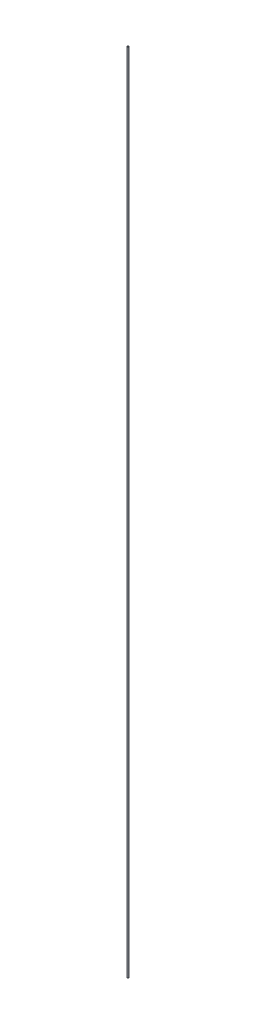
SolidWorks part; units mm, degrees
ref_plane "Plan de face" through (0, 0, 0) normal (0, 0, 1) x (1, 0, 0)
ref_plane "Plan de dessus" through (0, 0, 0) normal (0, 1, 0) x (1, 0, 0)
ref_plane "Plan de droite" through (0, 0, 0) normal (1, 0, 0) x (0, 0, -1)
sketch "Esquisse1" plane through (0, 0, 0) normal (0, 1, 0) x (1, 0, 0)
  circle A0 centre (0, 0) radius 1.5
  dimension "D1" = 3
extrude "Extrusion1" add sketch "Esquisse1" along normal blind 1680
